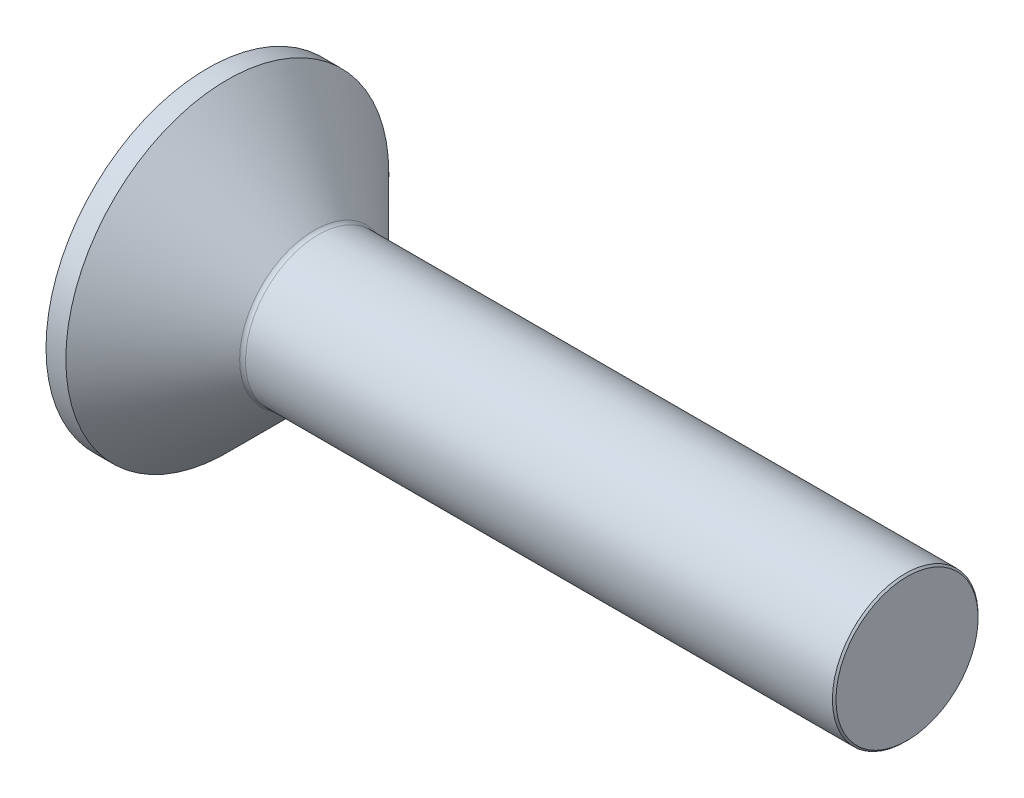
SolidWorks part; units mm, degrees
revolve "PreBroach" cut sketch "Sketch2"
sketch "Sketch2"
  line L0 (0, 1) -> (1.1, 1)
  line L1 (1.1, 1) -> (1.6774, 0)
  line L2 (0, 0) -> (127, 0) construction
  line L3 (1.6774, 0) -> (0, 0)
  line L4 (0, 0) -> (0, 1)
  line L5 (0, -1) -> (1.1, -1) construction
  line L6 (0, 0) -> (47.625, 0) construction
  line L8 (0, 2.77) -> (0, -2.77) construction
revolve "BaseBody" add sketch "BodySke"
sketch "BodySke" plane through (0, 0, 0) normal (0, 0, 1) x (1, 0, 0)
  line L0 (0, 0) -> (0, 2.77)
  line L1 (0.34, 2.77) -> (1.86, 1.25)
  line L2 (0, 2.77) -> (0.34, 2.77)
  line L3 (1.86, 1.25) -> (11.9695, 1.25)
  line L4 (12, 1.2195) -> (12, 0)
  line L5 (12, 0) -> (0, 0)
  line L6 (0, 0) -> (127, 0) construction
  line L7 (0.34, -2.77) -> (1.86, -1.25) construction
  line L8 (12, 1.2195) -> (11.9695, 1.25)
  line L9 (0, -2.77) -> (0.34, -2.77) construction
  line L10 (12, -1.2195) -> (11.9695, -1.25) construction
  line L11 (2.36, 7.6) -> (2.36, -14.625) construction
  line L12 (0, 19.05) -> (0, -3.175) construction
fillet "Fillet1" radius 0.1 1 edges at (1.86, 0, 1.25)
ref_plane "Plane1" through (0, 0, 0) normal (0, 0, 1) x (1, 0, 0)
ref_plane "Plane2" through (0, 0, 0) normal (0, 1, 0) x (1, 0, 0)
ref_plane "Plane3" through (0, 0, 0) normal (1, 0, 0) x (0, 0, -1)
other "Configuration Table"
sketch "Sketch3" plane through (0, 0, 0) normal (-1, 0, 0) x (0, 0, 1)
  line L0 (-1, -0.5774) -> (-1, 0.5774)
  line L1 (-1, 0.5774) -> (0, 1.1547)
  line L2 (0, 1.1547) -> (1, 0.5774)
  line L3 (1, 0.5774) -> (1, -0.5774)
  line L4 (1, -0.5774) -> (0, -1.1547)
  line L5 (0, -1.1547) -> (-1, -0.5774)
extrude "Hex" cut sketch "Sketch3" against normal blind 1.1
sketch "ThdSchSke" plane through (0, 0, 0) normal (0, 0, 1) x (1, 0, 0)
  line L0 (3.36, -1.2195) -> (3.3386, -1.25)
  line L1 (3.36, -1.2195) -> (3.3814, -1.25)
  line L2 (3.3814, -1.25) -> (3.3814, -1.5625)
  line L3 (-3.175, 0) -> (5.1513, 0) construction
  line L4 (0, 2.77) -> (0, -2.77) construction
  line L5 (3.3814, -1.5625) -> (3.3386, -1.5625)
  line L6 (3.3386, -1.5625) -> (3.3386, -1.25)
revolve "ThreadSchematic" [suppressed] cut sketch "ThdSchSke" angle 360 about L3
pattern_linear "ThdSchPat" [suppressed]
equation "\"Thread_minor@ThreadCosmetic\"  =  \"Minor_dia@BodySke\""
equation "\"D1@Sketch3\" = \"Hex_size@Sketch3\" / 2"
equation "\"D2@Sketch3\" = \"D1@Sketch3\""
equation "\"D3@Sketch3\" = \"Hex_size@Sketch3\""
equation "\"Thread_length@ThreadCosmetic\" = ((sgn( (\"Length@BodySke\" - \"Advance@BodySke\" * 3.0 - \"Head_ht@BodySke\" ) - \"Thread_nom@BodySke\" )-1)*( (\"Length@BodySke\" - \"Advance@BodySke\" * 3.0 - \"Head_ht@BodySke\" "
equation "\"Thread_minor@ThdSchSke\" = \"Minor_dia@BodySke\""
equation "\"Diameter@ThdSchSke\" = \"Diameter@BodySke\""
equation "\"Overcut@ThdSchSke\" = \"Diameter@BodySke\" * 1.25"
equation "\"Start@ThdSchSke\" = 0.000001 + \"Length@BodySke\" - \"Thread_length@ThreadCosmetic\"  '---Countersunk---"
equation "\"Num_threads@ThdSchPat\" = int( \"Thread_length@ThreadCosmetic\" / \"Advance@BodySke\" + 0.999 )  + 1"
equation "\"Advance@ThdSchPat\" = \"Thread_length@ThreadCosmetic\" /  (\"Num_threads@ThdSchPat\" - 1) 'relax it"
equation "\"Num_threads@ThdSchPat\" = \"Num_threads@ThdSchPat\" - sgn( \"Num_threads@ThdSchPat\" - 1) '---chamfered tips only---"
